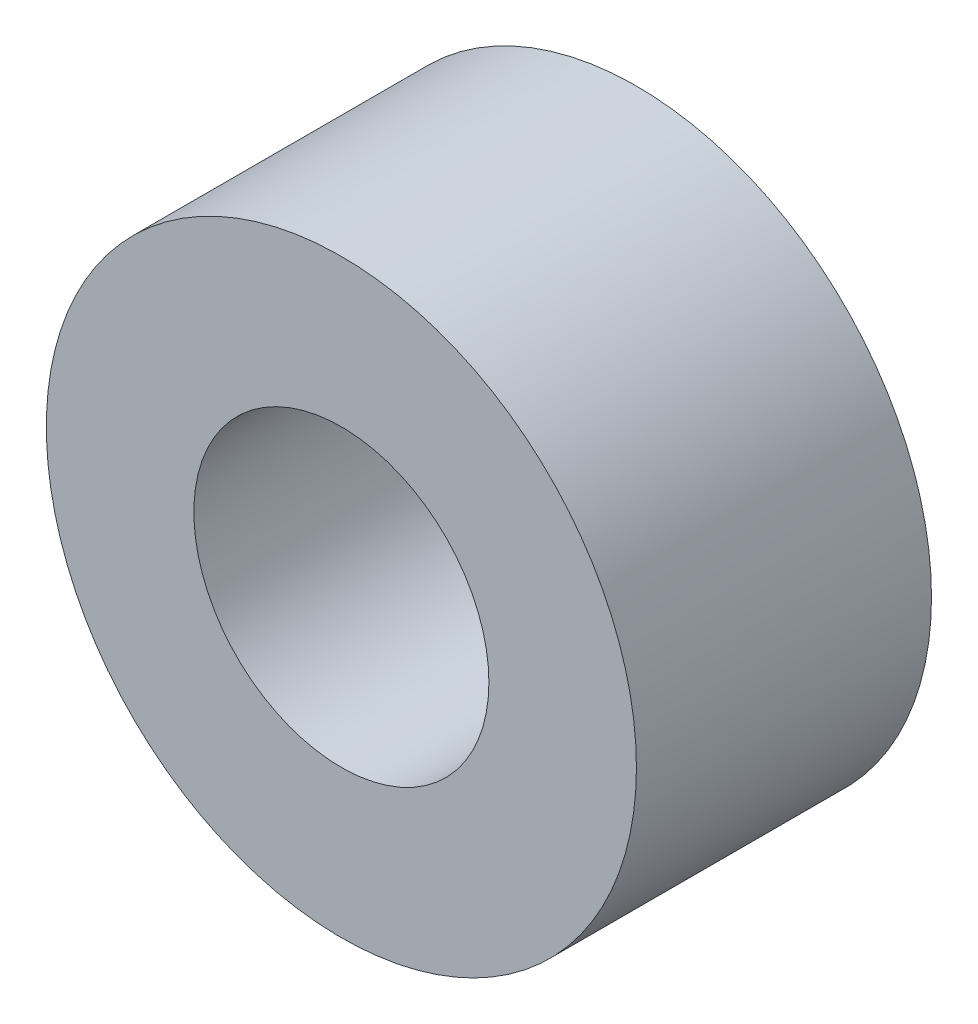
SolidWorks part; units mm, degrees
ref_plane "Ebene vorne" through (0, 0, 0) normal (0, 0, 1) x (1, 0, 0)
ref_plane "Ebene oben" through (0, 0, 0) normal (0, 1, 0) x (1, 0, 0)
ref_plane "Ebene rechts" through (0, 0, 0) normal (1, 0, 0) x (0, 0, -1)
sketch "Skizze1" plane through (0, 0, 0) normal (0, 0, 1) x (1, 0, 0)
  circle A0 centre (0, 0) radius 10
  circle A1 centre (0, 0) radius 20
  dimension "D1" = 40
  dimension "D2" = 20
extrude "Aufsatz-Linear austragen1" add sketch "Skizze1" along normal blind 20
